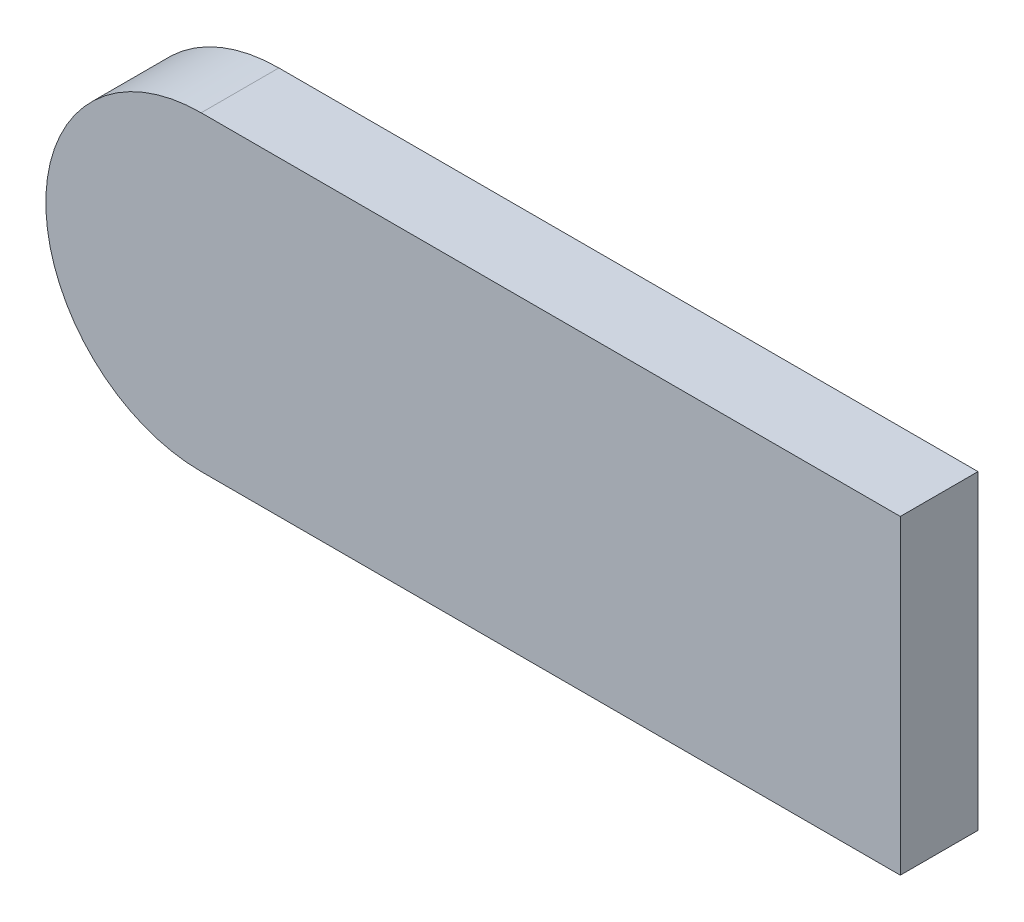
SolidWorks part; units mm, degrees
ref_plane "Front Plane" through (0, 0, 0) normal (0, 0, 1) x (1, 0, 0)
ref_plane "Top Plane" through (0, 0, 0) normal (0, 1, 0) x (1, 0, 0)
ref_plane "Right Plane" through (0, 0, 0) normal (1, 0, 0) x (0, 0, -1)
sketch "Sketch1" plane through (0, 0, 0) normal (0, 0, 1) x (1, 0, 0)
  line L1 (-45, 20) -> (45, 20)
  line L3 (-45, -20) -> (45, -20)
  line L4 (45, 20) -> (45, -20)
  line L5 (-45, 20) -> (45, -20) construction
  line L6 (-45, -20) -> (45, 20) construction
  arc A0 (-45, 20) -> (-45, -20) centre (-45, 0) ccw
  point P0 (0, 0)
  dimension "D1" = 40
  dimension "D2" = 90
extrude "Boss-Extrude1" add sketch "Sketch1" along normal blind 10
